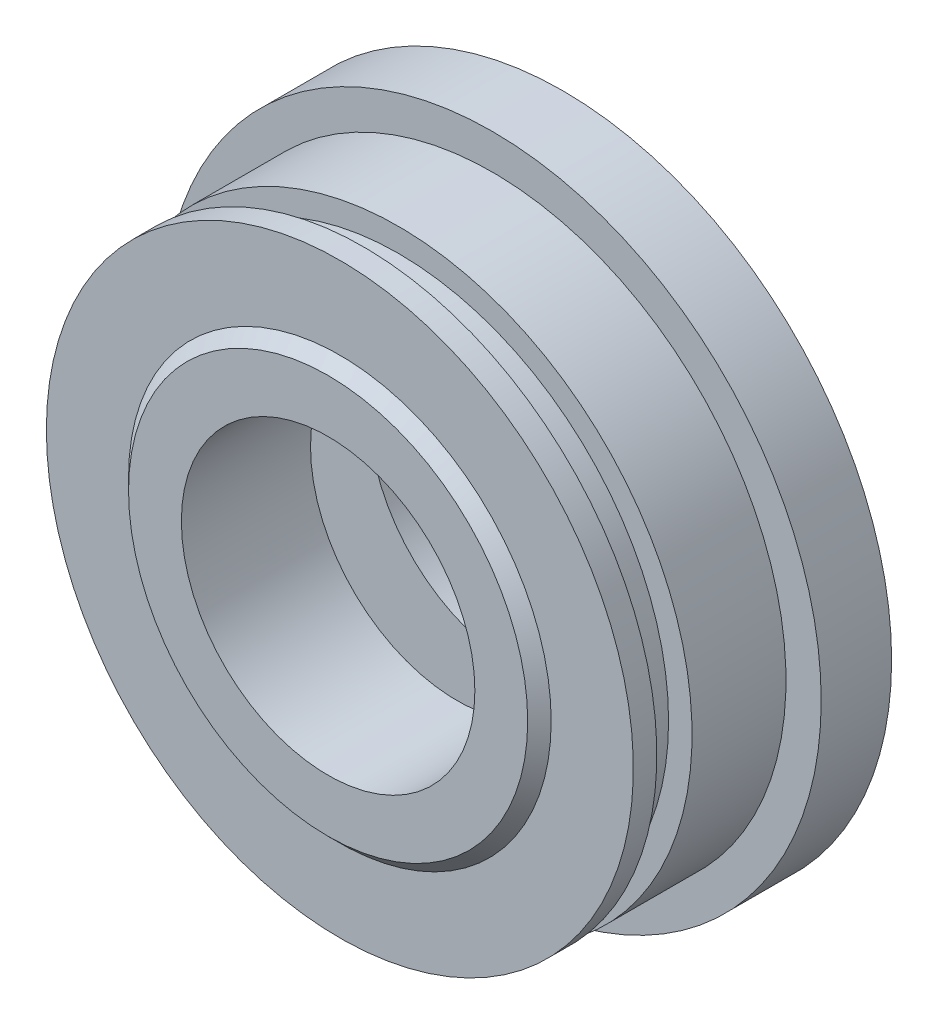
SolidWorks part; units mm, degrees
ref_plane "Plan1" through (0, 0, 0) normal (0, 0, 1) x (1, 0, 0)
ref_plane "Plan2" through (0, 0, 0) normal (0, 1, 0) x (1, 0, 0)
ref_plane "Plan3" through (0, 0, 0) normal (1, 0, 0) x (0, 0, -1)
sketch "Esquisse1" plane through (0, 0, 0) normal (0, 0, 1) x (1, 0, 0)
  circle A0 centre (0, 0) radius 14
  dimension "D1" = 28
extrude "cylindre" add sketch "Esquisse1" along normal blind 3
sketch "Esquisse2" plane through (0, 0, 3) normal (0, 0, 1) x (1, 0, 0)
  circle A0 centre (0, 0) radius 12.5
  dimension "D1" = 25
extrude "epaulement" add sketch "Esquisse2" along normal blind 6.5
sketch "Esquisse3" plane through (0, 0, 9.5) normal (0, 0, 1) x (1, 0, 0)
  circle A0 centre (0, 0) radius 9
  dimension "D1" = 18
extrude "bossage" add sketch "Esquisse3" along normal blind 0.5 draft 45
sketch "Esquisse4" plane through (0, 0, 10) normal (0, 0, 1) x (1, 0, 0)
  circle A0 centre (0, 0) radius 6.25
  dimension "D1" = 12.5
extrude "perçage" cut sketch "Esquisse4" against normal through all
sketch "Esquisse10" plane through (0, 0, 0) normal (1, 0, 0) x (0, 0, -1)
  line L0 (0, 0) -> (-30, 0) construction
  line L1 (-2, -5.25) -> (-4.5, -5.25)
  line L2 (-2, -5.25) -> (-2, -10.25)
  line L3 (-4.5, -10.25) -> (-2, -10.25)
  line L4 (-4.5, -10.25) -> (-4.5, -5.25)
  line L5 (0, -14) -> (0, 14) construction
  line L6 (-10, -6.25) -> (0, -6.25) construction
  dimension "D1" = 2.5
  dimension "D2" = 5
  dimension "D3" = 2
  dimension "D4" = 4
revolve "gorge 16" cut sketch "Esquisse10" angle 360 about L0
sketch "Esquisse11" plane through (0, 0, 0) normal (1, 0, 0) x (0, 0, -1)
  line L0 (0, 0) -> (-30, 0) construction
  line L1 (-8.5, -14) -> (-7, -14)
  line L2 (-8.5, -14) -> (-8.5, -11.5)
  line L3 (-7, -11.5) -> (-8.5, -11.5)
  line L4 (-7, -11.5) -> (-7, -14)
  line L5 (0, -14) -> (0, 14) construction
  dimension "D1" = 1.5
  dimension "D2" = 2.5
  dimension "D3" = 11.5
  dimension "D4" = 7
revolve "gorge 17" cut sketch "Esquisse11" angle 360 about L0
sketch "point d'encrage A" plane through (0, 0, 10) normal (0, 0, 1) x (1, 0, 0)
  point P0 (0, 0)
